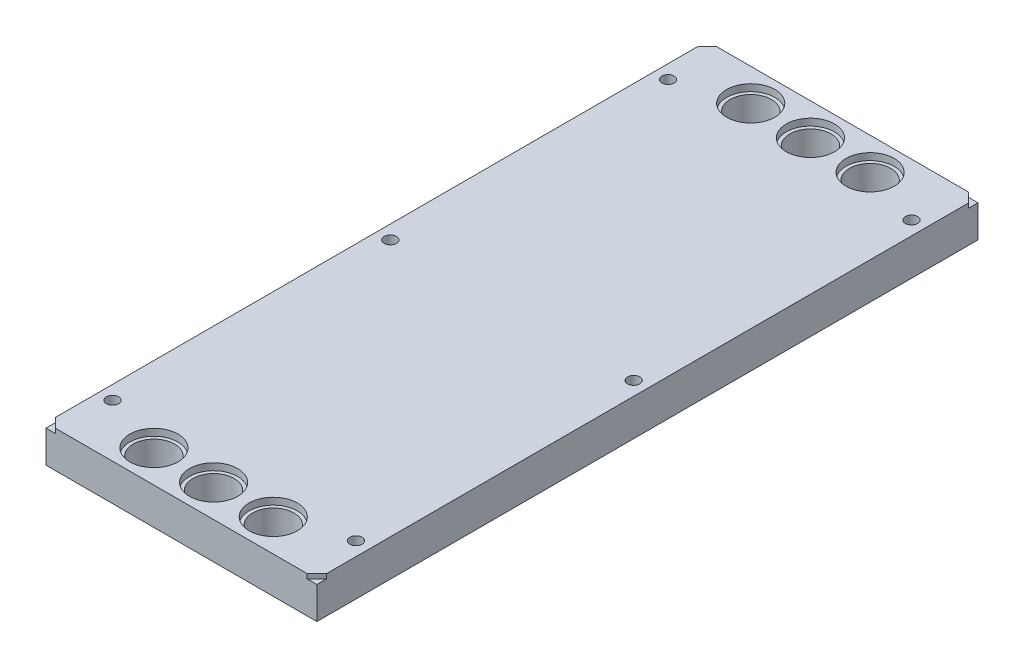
SolidWorks part; units mm, degrees
ref_plane "Plane1" through (0, 0, 0) normal (0, 0, 1) x (1, 0, 0)
ref_plane "Plane2" through (0, 0, 0) normal (0, 1, 0) x (1, 0, 0)
ref_plane "Plane3" through (0, 0, 0) normal (1, 0, 0) x (0, 0, -1)
sketch "Sketch1" plane through (0, 0, 0) normal (0, 0, 1) x (1, 0, 0)
  line L0 (-93.6625, 0) -> (93.6625, 0)
  line L1 (-93.6625, 0) -> (-93.6625, -25.4)
  line L2 (93.6625, -25.4) -> (-93.6625, -25.4)
  line L3 (93.6625, -25.4) -> (93.6625, 0)
  dimension "HT" = 25.4
  dimension "W" = 187.325
  dimension "halfW" = 93.6625
extrude "Base-Extrude" add sketch "Sketch1" along normal mid plane 457.2
hole_wizard "CBORE1" positions "CB1ctrl" profile "CB1rev" legacy
sketch "CB1ctrl" plane through (0, -25.4, 0) normal (0, -1, 0) x (1, 0, 0)
  point P0 (84.1375, -192.0875)
sketch "CB1rev" plane through (84.1375, -25.4, -192.0875) normal (1, 0, 0) x (0, 0, -1)
  line L0 (0, 0) -> (0, 25.4)
  line L1 (0, 25.4) -> (4.2164, 25.4)
  line L2 (4.2164, 25.4) -> (4.2164, 7.9375)
  line L3 (4.2164, 7.9375) -> (6.7469, 7.9375)
  line L4 (6.7469, 7.9375) -> (6.7469, 0)
  line L5 (6.7469, 0) -> (0, 0)
  line L6 (0, 110) -> (0, -10) construction
  dimension "Depth" = 25.4
hole_wizard "CBORE2" positions "CB2ctrl" profile "CB2rev" legacy
sketch "CB2ctrl" plane through (0, -25.4, 0) normal (0, -1, 0) x (1, 0, 0)
  point P0 (84.1375, 192.0875)
sketch "CB2rev" plane through (84.1375, -25.4, 192.0875) normal (1, 0, 0) x (0, 0, -1)
  line L0 (0, 0) -> (0, 25.4)
  line L1 (0, 25.4) -> (4.2164, 25.4)
  line L2 (4.2164, 25.4) -> (4.2164, 7.9375)
  line L3 (4.2164, 7.9375) -> (6.7469, 7.9375)
  line L4 (6.7469, 7.9375) -> (6.7469, 0)
  line L5 (6.7469, 0) -> (0, 0)
  line L6 (0, 110) -> (0, -10) construction
  dimension "Depth" = 25.4
hole_wizard "CBORE3" positions "CB3ctrl" profile "CB3rev" legacy
sketch "CB3ctrl" plane through (0, -25.4, 0) normal (0, -1, 0) x (1, 0, 0)
  point P0 (-84.1375, 192.0875)
sketch "CB3rev" plane through (-84.1375, -25.4, 192.0875) normal (1, 0, 0) x (0, 0, -1)
  line L0 (0, 0) -> (0, 25.4)
  line L1 (0, 25.4) -> (4.2164, 25.4)
  line L2 (4.2164, 25.4) -> (4.2164, 7.9375)
  line L3 (4.2164, 7.9375) -> (6.7469, 7.9375)
  line L4 (6.7469, 7.9375) -> (6.7469, 0)
  line L5 (6.7469, 0) -> (0, 0)
  line L6 (0, 110) -> (0, -10) construction
  dimension "Depth" = 25.4
hole_wizard "CBORE4" positions "CB4ctrl" profile "CB4rev" legacy
sketch "CB4ctrl" plane through (0, -25.4, 0) normal (0, -1, 0) x (1, 0, 0)
  point P0 (-84.1375, -192.0875)
sketch "CB4rev" plane through (-84.1375, -25.4, -192.0875) normal (1, 0, 0) x (0, 0, -1)
  line L0 (0, 0) -> (0, 25.4)
  line L1 (0, 25.4) -> (4.2164, 25.4)
  line L2 (4.2164, 25.4) -> (4.2164, 7.9375)
  line L3 (4.2164, 7.9375) -> (6.7469, 7.9375)
  line L4 (6.7469, 7.9375) -> (6.7469, 0)
  line L5 (6.7469, 0) -> (0, 0)
  line L6 (0, 110) -> (0, -10) construction
  dimension "Depth" = 25.4
sketch "Sketch3" plane through (0, 0, 0) normal (0, 1, 0) x (-1, 0, 0)
  line L0 (-86.9273, 228.6) -> (-93.6625, 221.8648)
  line L1 (93.6625, 228.6) -> (-93.6625, 228.6) construction
  line L2 (-93.6625, 228.6) -> (-93.6625, -228.6) construction
  line L3 (-93.6625, 221.8648) -> (-93.6625, 228.6)
  line L4 (-93.6625, 228.6) -> (-86.9273, 228.6)
  dimension "D1" = 9.525
  dimension "D2" = 45
extrude "Cut-Extrude1" cut sketch "Sketch3" against normal blind 3.175
mirror "Mirror1" about plane through (0, 0, 0) normal (1, 0, 0) of "Cut-Extrude1"
mirror "Mirror2" about plane through (0, 0, 0) normal (0, 0, 1) of "Mirror1", "Cut-Extrude1"
hole_wizard "SP1" positions "SP1ctrl" profile "SP1rev" legacy
sketch "SP1ctrl" plane through (0, -25.4, 0) normal (0, -1, 0) x (1, 0, 0)
  line L0 (50, 0) -> (-50, 0) construction
  line L1 (0, -50) -> (0, 50) construction
  point P0 (-71.4375, -217.4875)
sketch "SP1rev" plane through (-71.4375, -25.4, -217.4875) normal (1, 0, 0) x (0, 0, -1)
  line L0 (0, 0) -> (0, 18.2596)
  line L1 (0, 18.2596) -> (3.9687, 15.875)
  line L2 (3.9687, 15.875) -> (3.9687, 0.0025)
  line L3 (3.9687, 0.0025) -> (3.9687, 0)
  line L5 (3.9687, 0) -> (0, 0)
  line L6 (-3.9687, 0.0025) -> (-3.9687, 0) construction
  line L10 (0, 18.2596) -> (-3.9687, 15.875) construction
  line L11 (0, -6.35) -> (0, 107.95) construction
hole_wizard "SP2" positions "SP2ctrl" profile "SP2rev" legacy
sketch "SP2ctrl" plane through (0, -25.4, 0) normal (0, -1, 0) x (1, 0, 0)
  line L0 (50, 0) -> (-50, 0) construction
  line L1 (0, -50) -> (0, 50) construction
  point P0 (-71.4375, 217.4875)
sketch "SP2rev" plane through (-71.4375, -25.4, 217.4875) normal (1, 0, 0) x (0, 0, -1)
  line L0 (0, 0) -> (0, 18.2596)
  line L1 (0, 18.2596) -> (3.9687, 15.875)
  line L2 (3.9687, 15.875) -> (3.9687, 0.0025)
  line L3 (3.9687, 0.0025) -> (3.9687, 0)
  line L5 (3.9687, 0) -> (0, 0)
  line L6 (-3.9687, 0.0025) -> (-3.9687, 0) construction
  line L10 (0, 18.2596) -> (-3.9687, 15.875) construction
  line L11 (0, -6.35) -> (0, 107.95) construction
hole_wizard "SP3" positions "SP3ctrl" profile "SP3rev" legacy
sketch "SP3ctrl" plane through (0, -25.4, 0) normal (0, -1, 0) x (1, 0, 0)
  line L0 (0, -50) -> (0, 50) construction
  point P0 (-71.4375, 0.2189)
sketch "SP3rev" plane through (-71.4375, -25.4, 0.2189) normal (1, 0, 0) x (0, 0, -1)
  line L0 (0, 0) -> (0, 18.2596)
  line L1 (0, 18.2596) -> (3.9687, 15.875)
  line L2 (3.9687, 15.875) -> (3.9687, 0.0025)
  line L3 (3.9687, 0.0025) -> (3.9687, 0)
  line L5 (3.9687, 0) -> (0, 0)
  line L6 (-3.9687, 0.0025) -> (-3.9687, 0) construction
  line L10 (0, 18.2596) -> (-3.9687, 15.875) construction
  line L11 (0, -6.35) -> (0, 107.95) construction
hole_wizard "SP4" positions "SP4ctrl" profile "SP4rev" legacy
sketch "SP4ctrl" plane through (0, -25.4, 0) normal (0, -1, 0) x (1, 0, 0)
  line L0 (0, -50) -> (0, 50) construction
  line L1 (50, 0) -> (-50, 0) construction
  point P0 (-71.4375, 101.6)
sketch "SP4rev" plane through (-71.4375, -25.4, 101.6) normal (1, 0, 0) x (0, 0, -1)
  line L0 (0, 0) -> (0, 18.2596)
  line L1 (0, 18.2596) -> (3.9687, 15.875)
  line L2 (3.9687, 15.875) -> (3.9687, 0.0025)
  line L3 (3.9687, 0.0025) -> (3.9687, 0)
  line L5 (3.9687, 0) -> (0, 0)
  line L6 (-3.9687, 0.0025) -> (-3.9687, 0) construction
  line L10 (0, 18.2596) -> (-3.9687, 15.875) construction
  line L11 (0, -6.35) -> (0, 107.95) construction
hole_wizard "SP5" positions "SP5ctrl" profile "SP5rev" legacy
sketch "SP5ctrl" plane through (0, -25.4, 0) normal (0, -1, 0) x (1, 0, 0)
  line L0 (50, 0) -> (-50, 0) construction
  line L1 (0, -50) -> (0, 50) construction
  point P0 (-71.4375, -101.6)
sketch "SP5rev" plane through (-71.4375, -25.4, -101.6) normal (1, 0, 0) x (0, 0, -1)
  line L0 (0, 0) -> (0, 18.2596)
  line L1 (0, 18.2596) -> (3.9687, 15.875)
  line L2 (3.9687, 15.875) -> (3.9687, 0.0025)
  line L3 (3.9687, 0.0025) -> (3.9687, 0)
  line L5 (3.9687, 0) -> (0, 0)
  line L6 (-3.9687, 0.0025) -> (-3.9687, 0) construction
  line L10 (0, 18.2596) -> (-3.9687, 15.875) construction
  line L11 (0, -6.35) -> (0, 107.95) construction
hole_wizard "SP6" positions "SP6ctrl" profile "SP6rev" legacy
sketch "SP6ctrl" plane through (113.9815, -25.4, -9.2865) normal (0, -1, 0) x (1, 0, 0)
  line L2 (-63.9815, 9.2865) -> (-163.9815, 9.2865) construction
  line L3 (-113.9815, -40.7135) -> (-113.9815, 59.2865) construction
  point P0 (-42.544, -205.026)
sketch "SP6rev" plane through (71.4375, -25.4, -214.3125) normal (1, 0, 0) x (0, 0, -1)
  line L0 (0, 0) -> (0, 18.2596)
  line L1 (0, 18.2596) -> (3.9687, 15.875)
  line L2 (3.9687, 15.875) -> (3.9687, 0.0025)
  line L3 (3.9687, 0.0025) -> (3.9687, 0)
  line L5 (3.9687, 0) -> (0, 0)
  line L6 (-3.9687, 0.0025) -> (-3.9687, 0) construction
  line L10 (0, 18.2596) -> (-3.9687, 15.875) construction
  line L11 (0, -6.35) -> (0, 107.95) construction
other "Guide1"
sketch "Eject1" plane through (0, 0, 0) normal (0, 1, 0) x (-1, 0, 0)
  circle A0 centre (-41.275, -206.375) radius 14.2875
sketch "Eject2" plane through (-11.9665, 0, 139.2052) normal (0, 1, 0) x (-1, 0, 0)
  circle A0 centre (-53.2415, 67.1698) radius 14.2875
other "Guide2"
sketch "Eject3" plane through (-66.4317, 0, 141.1332) normal (0, 1, 0) x (-1, 0, 0)
  circle A0 centre (-25.1567, 65.2418) radius 14.2875
other "Guide3"
sketch "Eject4" plane through (-66.7489, 0, -4.669) normal (0, 1, 0) x (-1, 0, 0)
  circle A0 centre (-25.4739, -201.706) radius 14.2875
other "Guide4"
sketch "Eject5" plane through (-35.2765, 0, -4.9474) normal (0, 1, 0) x (-1, 0, 0)
  line L1 (-35.2765, 54.9474) -> (-35.2765, -45.0526) construction
  circle A0 centre (-35.2765, -201.4276) radius 14.2875
other "Guide5"
sketch "Eject6" plane through (-39.5377, 0, 137.2242) normal (0, 1, 0) x (-1, 0, 0)
  line L0 (-39.5377, -87.2242) -> (-39.5377, -187.2242) construction
  circle A0 centre (-39.5377, 69.1508) radius 14.2875
other "Guide6"
other "Gbore1" parameters "D1"=4.7625
sketch "Sketch4" plane through (0, 0, 0) normal (0, 1, 0) x (-1, 0, 0)
  circle A0 centre (-41.275, -206.375) radius 16.6688
  circle A1 centre (-41.275, -206.375) radius 14.2875 construction
sketch "Sketch5" plane through (-2.5953, 0, 135.6888) normal (0, 1, 0) x (-1, 0, 0)
  circle A0 centre (-43.8703, 70.6862) radius 16.6687
  circle A2 centre (-43.8703, 70.6862) radius 14.2875 construction
other "Gbore2" parameters "D1"=4.7625
sketch "Sketch6" plane through (-90.5382, 0, 140.671) normal (0, 1, 0) x (-1, 0, 0)
  circle A0 centre (-49.2632, 65.704) radius 16.6687
  circle A2 centre (-49.2632, 65.704) radius 14.2875 construction
other "Gbore3" parameters "D1"=4.7625
sketch "Sketch7" plane through (-89.2843, 0, 16.8335) normal (0, 1, 0) x (-1, 0, 0)
  circle A0 centre (-48.0093, -223.2085) radius 16.6687
  circle A2 centre (-48.0093, -223.2085) radius 14.2875 construction
other "Gbore4" parameters "D1"=4.7625
sketch "Sketch8" plane through (-38.0974, 0, 20.1282) normal (0, 1, 0) x (-1, 0, 0)
  circle A0 centre (-38.0974, -226.5032) radius 16.6688
  circle A2 centre (-38.0974, -226.5032) radius 14.2875 construction
other "Gbore5" parameters "D1"=4.7625
sketch "Sketch9" plane through (-49.4485, 0, 136.7279) normal (0, 1, 0) x (-1, 0, 0)
  circle A0 centre (-49.4485, 69.6471) radius 16.6688
  circle A2 centre (-49.4485, 69.6471) radius 14.2875 construction
other "Gbore6" parameters "D1"=4.7625
hole_wizard "CBORE5" positions "CB5ctrl" profile "CB5rev" legacy
sketch "CB5ctrl" plane through (3.9155, -25.4, 85.049) normal (0, -1, 0) x (1, 0, 0)
  line L0 (46.0845, -85.049) -> (-53.9155, -85.049) construction
  point P0 (80.222, -85.049)
sketch "CB5rev" plane through (84.1375, -25.4, 0) normal (1, 0, 0) x (0, 0, -1)
  line L0 (0, 0) -> (0, 25.4)
  line L1 (0, 25.4) -> (4.2164, 25.4)
  line L2 (4.2164, 25.4) -> (4.2164, 7.9375)
  line L3 (4.2164, 7.9375) -> (6.7469, 7.9375)
  line L4 (6.7469, 7.9375) -> (6.7469, 0)
  line L5 (6.7469, 0) -> (0, 0)
  line L6 (0, 110) -> (0, -10) construction
  dimension "Diameter" = 8.4328
  dimension "Depth" = 25.4
  dimension "C-Bore Diameter" = 13.4937
  dimension "C-Bore Depth" = 7.9375
hole_wizard "CBORE6" positions "CB6ctrl" profile "CB6rev" legacy
sketch "CB6ctrl" plane through (-174.0135, -25.4, 84.7132) normal (0, -1, 0) x (1, 0, 0)
  line L0 (224.0135, -84.7132) -> (124.0135, -84.7132) construction
  point P0 (89.876, -84.7132)
sketch "CB6rev" plane through (-84.1375, -25.4, 0) normal (1, 0, 0) x (0, 0, -1)
  line L0 (0, 0) -> (0, 25.4)
  line L1 (0, 25.4) -> (4.2164, 25.4)
  line L2 (4.2164, 25.4) -> (4.2164, 7.9375)
  line L3 (4.2164, 7.9375) -> (6.7469, 7.9375)
  line L4 (6.7469, 7.9375) -> (6.7469, 0)
  line L5 (6.7469, 0) -> (0, 0)
  line L6 (0, 110) -> (0, -10) construction
  dimension "Diameter" = 8.4328
  dimension "Depth" = 25.4
  dimension "C-Bore Diameter" = 13.4937
  dimension "C-Bore Depth" = 7.9375
mirror "Mirror3" about plane through (0, 0, 0) normal (1, 0, 0) of "SP3"
mirror "Mirror4" about plane through (0, 0, 0) normal (1, 0, 0) of "SP5", "SP4"
mirror "Mirror5" about plane through (0, 0, 0) normal (1, 0, 0) of "SP2"
equation "\"SP6Y@SP6ctrl\" = \"SP1Y@SP1ctrl\" - .125"
